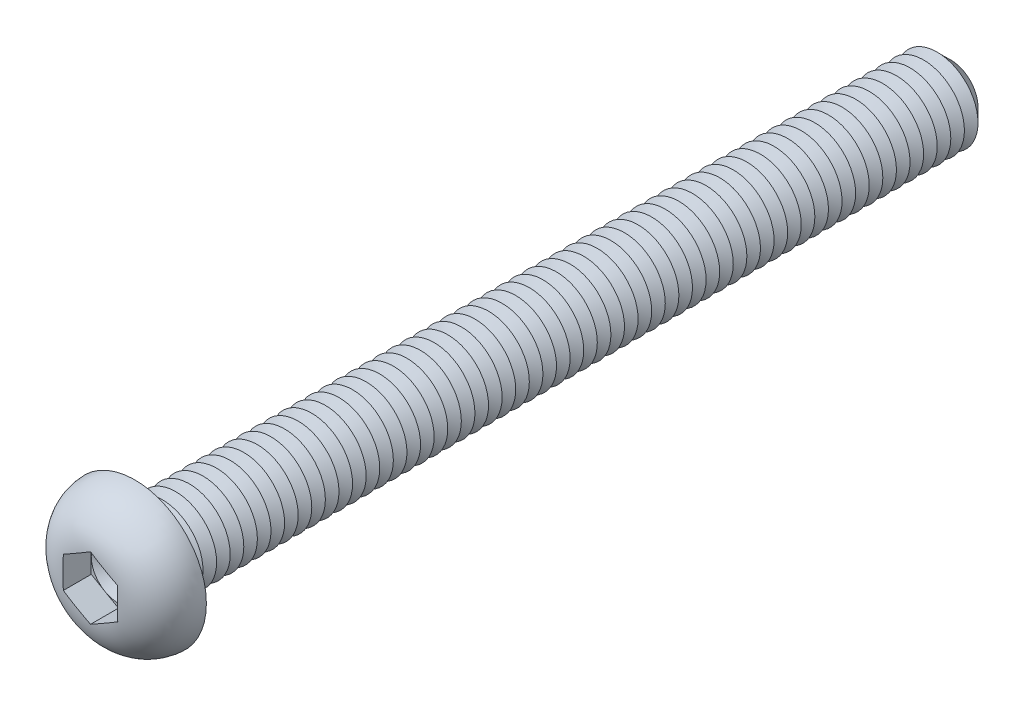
SolidWorks part; units mm, degrees
ref_plane "Front Plane" through (0, 0, 0) normal (0, 0, 1) x (1, 0, 0)
ref_plane "Top Plane" through (0, 0, 0) normal (0, 1, 0) x (1, 0, 0)
ref_plane "Right Plane" through (0, 0, 0) normal (1, 0, 0) x (0, 0, -1)
sketch "Sketch1" plane through (0, 0, 0) normal (1, 0, 0) x (0, 0, -1)
  line L0 (-47.9342, 0) -> (60.3146, 0) construction
sketch "Sketch2" plane through (0, 0, 0) normal (1, 0, 0) x (0, 0, -1)
  line L0 (0, 0) -> (-3.3, 0)
  line L1 (-47.9342, 0) -> (60.3146, 0) construction
  line L2 (-3.3, 0) -> (-3.3, 1.8515)
  line L3 (0, 5.25) -> (0, 0)
  arc A0 (-3.3, 1.8515) -> (0, 5.25) centre (0.1, 1.8515) cw
  dimension "D1" = 3.4
  dimension "D2" = 3.3
  dimension "D3" = 5.25
revolve "Revolve1" add sketch "Sketch2" angle 360 about L0
sketch "Sketch3" plane through (0, 0, 3.3) normal (0, 0, 1) x (1, 0, 0)
  line L1 (0, 2.3094) -> (-2, 1.1547)
  line L2 (-2, 1.1547) -> (-2, -1.1547)
  line L3 (-2, -1.1547) -> (0, -2.3094)
  line L4 (0, -2.3094) -> (2, -1.1547)
  line L5 (2, -1.1547) -> (2, 1.1547)
  line L6 (2, 1.1547) -> (0, 2.3094)
  circle A0 centre (0, 0) radius 2 construction
  dimension "D1" = 4
extrude "Cut-Extrude1" cut sketch "Sketch3" against normal blind 2.08
sketch "Sketch4" plane through (0, 0, 0) normal (0, 0, -1) x (-1, 0, 0)
  circle A0 centre (0, 0) radius 3
  dimension "D1" = 6
extrude "Boss-Extrude1" add sketch "Sketch4" along normal blind 60
chamfer "Chamfer1" distance 1 angle 45 1 edges at (-3, 0, -60)
sketch "Sketch5" plane through (0, 0, 0) normal (1, 0, 0) x (0, 0, -1)
  line L0 (1, 3) -> (2, 3)
  line L1 (59, 3) -> (0, 3) construction
  line L2 (2, 3) -> (1.5, 2.134)
  line L3 (1.5, 2.134) -> (1, 3)
  line L4 (0, -5.25) -> (0, 5.25) construction
  line L5 (59, 3) -> (0, 3) construction
  dimension "D1" = 1
  dimension "D2" = 1
revolve "Cut-Revolve1" cut sketch "Sketch5" angle 360 about L0
pattern_linear "LPattern1" count 58 spacing 1 along (0, 0, -1) of "Cut-Revolve1"
fillet "Fillet2" radius 0.5 1 edges at (-3, 0, 0)
sketch "Sketch6" plane through (0, 0, 1.22) normal (0, 0, 1) x (1, 0, 0)
  line L0 (0, -2.3094) -> (2, -1.1547) construction
  circle A0 centre (0, 0) radius 2
extrude "Cut-Extrude2" cut sketch "Sketch6" against normal through all draft 60
